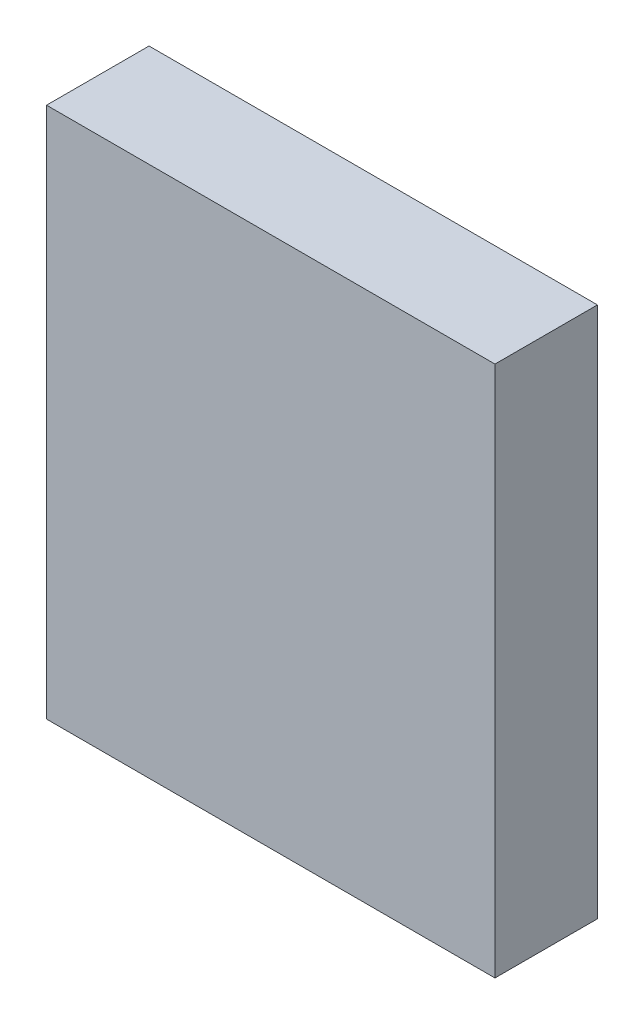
SolidWorks part; units mm, degrees
ref_plane "Plan de face" through (0, 0, 0) normal (0, 0, 1) x (1, 0, 0)
ref_plane "Plan de dessus" through (0, 0, 0) normal (0, 1, 0) x (1, 0, 0)
ref_plane "Plan de droite" through (0, 0, 0) normal (1, 0, 0) x (0, 0, -1)
sketch "Esquisse1" plane through (0, 0, 0) normal (0, 0, 1) x (1, 0, 0)
  line L1 (0, 0) -> (35, 0)
  line L2 (0, 0) -> (0, 41.5)
  line L3 (0, 41.5) -> (35, 41.5)
  line L4 (35, 0) -> (35, 41.5)
  dimension "D1" = 35
  dimension "D2" = 41.5
extrude "Extrusion1" add sketch "Esquisse1" along normal blind 8
